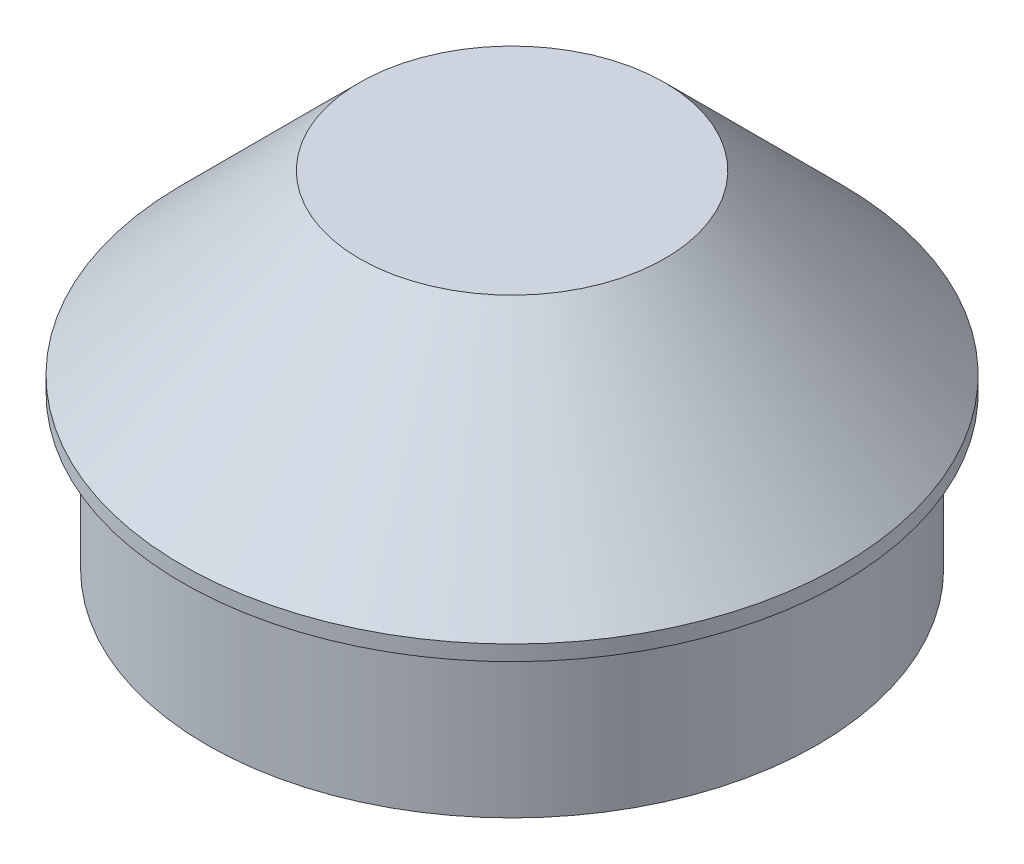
SolidWorks part; units mm, degrees
ref_plane "Front Plane" through (0, 0, 0) normal (0, 0, 1) x (1, 0, 0)
ref_plane "Top Plane" through (0, 0, 0) normal (0, 1, 0) x (1, 0, 0)
ref_plane "Right Plane" through (0, 0, 0) normal (1, 0, 0) x (0, 0, -1)
sketch "Sketch1" plane through (0, 0, 0) normal (0, 0, 1) x (1, 0, 0)
  line L0 (-12.7, 28.702) -> (-27.432, 13.97)
  line L1 (-27.432, 13.97) -> (-27.432, 12.7)
  line L2 (-27.432, 12.7) -> (-25.4, 12.7)
  line L3 (-25.4, 12.7) -> (-25.4, 0)
  line L4 (-25.4, 0) -> (0, 0)
  line L5 (0, 0) -> (0, 28.702)
  line L6 (0, 28.702) -> (-12.7, 28.702)
  line L7 (0, 0) -> (0, 101.2864) construction
  dimension "D1" = 50.8
  dimension "D2" = 12.7
  dimension "D3" = 45
  dimension "D4" = 1.27
  dimension "D5" = 25.4
  dimension "D6" = 2.032
revolve "Revolve1" add sketch "Sketch1" angle 360 about L7
